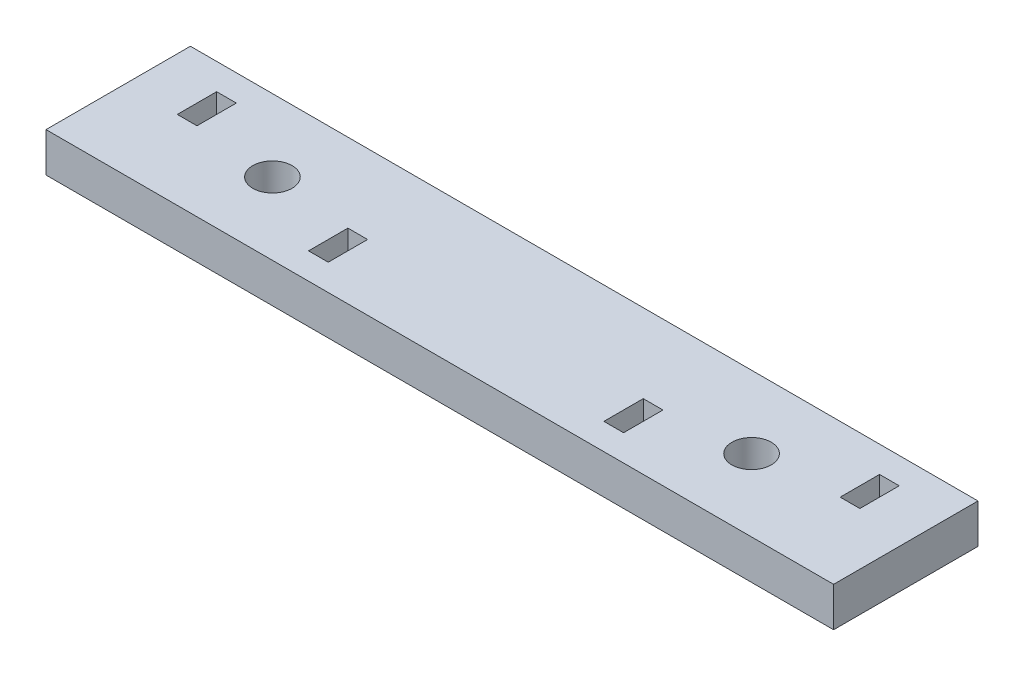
SolidWorks part; units mm, degrees
ref_plane "Front Plane" through (0, 0, 0) normal (0, 0, 1) x (1, 0, 0)
ref_plane "Top Plane" through (0, 0, 0) normal (0, 1, 0) x (1, 0, 0)
ref_plane "Right Plane" through (0, 0, 0) normal (1, 0, 0) x (0, 0, -1)
sketch "Sketch1" plane through (0, 0, 0) normal (0, 1, 0) x (1, 0, 0)
  line L0 (381, 69.85) -> (381, 57.15)
  line L1 (381, 69.85) -> (0, 69.85)
  line L2 (381, 69.85) -> (381, 0)
  line L3 (381, 0) -> (0, 0)
  line L4 (0, 69.85) -> (0, 0)
  line L5 (381, 57.15) -> (355.6, 57.15)
  line L6 (381, 0) -> (381, 12.7)
  line L7 (355.6, 57.15) -> (346.075, 57.15)
  line L8 (355.6, 57.15) -> (355.6, 38.1)
  line L9 (355.6, 47.625) -> (346.075, 47.625)
  line L10 (346.075, 57.15) -> (346.075, 38.1)
  line L11 (381, 12.7) -> (266.7, 12.7)
  line L12 (346.075, 34.925) -> (266.7, 34.925)
  line L13 (266.7, 12.7) -> (257.175, 12.7)
  line L14 (266.7, 12.7) -> (266.7, 31.75)
  line L15 (266.7, 22.225) -> (257.175, 22.225)
  line L16 (257.175, 12.7) -> (257.175, 31.75)
  line L17 (306.3875, 44.45) -> (325.4375, 44.45)
  line L18 (190.5, 0) -> (190.5, 69.85)
  line L19 (74.6125, 44.45) -> (55.5625, 44.45)
  line L20 (123.825, 12.7) -> (123.825, 31.75)
  line L21 (114.3, 22.225) -> (123.825, 22.225)
  line L22 (114.3, 12.7) -> (114.3, 31.75)
  line L23 (114.3, 12.7) -> (123.825, 12.7)
  line L24 (34.925, 34.925) -> (114.3, 34.925)
  line L25 (34.925, 57.15) -> (34.925, 38.1)
  line L26 (25.4, 47.625) -> (34.925, 47.625)
  line L27 (25.4, 57.15) -> (25.4, 38.1)
  line L28 (25.4, 57.15) -> (34.925, 57.15)
  line L29 (25.4, 38.1) -> (34.925, 38.1)
  line L30 (114.3, 31.75) -> (123.825, 31.75)
  line L31 (266.7, 31.75) -> (257.175, 31.75)
  line L32 (355.6, 38.1) -> (346.075, 38.1)
  circle A0 centre (306.3875, 34.925) radius 9.525
  circle A3 centre (74.6125, 34.925) radius 9.525
  dimension "D11" = 19.05
  dimension "D12" = 74.6125
  dimension "D13" = 22.225
  dimension "D1" = 381
  dimension "D2" = 69.85
  dimension "D3" = 9.525
  dimension "D4" = 9.525
  dimension "D5" = 25.4
  dimension "D6" = 12.7
  dimension "D7" = 9.525
  dimension "D8" = 9.525
  dimension "D9" = 114.3
  dimension "D10" = 12.7
extrude "Boss-Extrude1" add sketch "Sketch1" along normal blind 19.05
